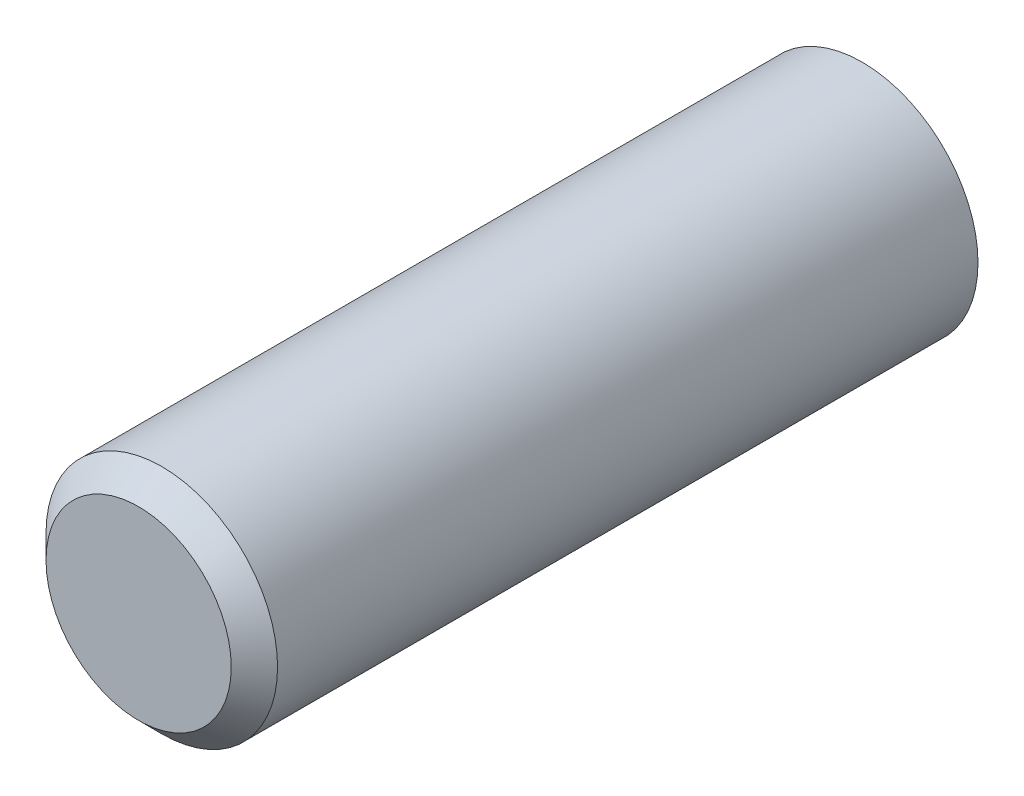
SolidWorks part; units mm, degrees
ref_plane "Front Plane" through (0, 0, 0) normal (0, 0, 1) x (1, 0, 0)
ref_plane "Top Plane" through (0, 0, 0) normal (0, 1, 0) x (1, 0, 0)
ref_plane "Right Plane" through (0, 0, 0) normal (1, 0, 0) x (0, 0, -1)
sketch "Sketch2" plane through (0, 0, 0) normal (0, 0, 1) x (1, 0, 0)
  circle A0 centre (0, 0) radius 8
  dimension "D1" = 16
extrude "Boss-Extrude1" add sketch "Sketch2" along normal mid plane 50
chamfer "Chamfer1" distance 1.6 angle 45 1 edges at (8, 0, 25)
